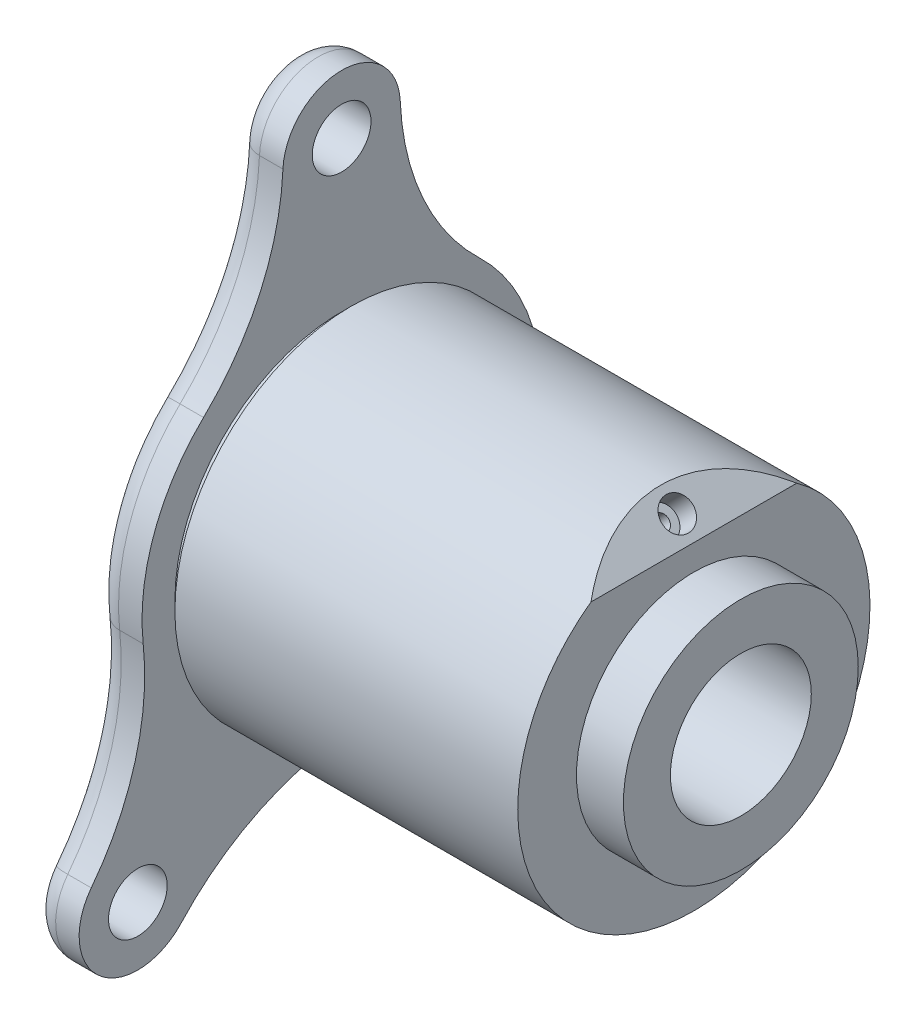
SolidWorks part; units mm, degrees
ref_plane "Front" through (0, 0, 0) normal (0, 0, 1) x (1, 0, 0)
ref_plane "Top" through (0, 0, 0) normal (0, 1, 0) x (1, 0, 0)
ref_plane "Right" through (0, 0, 0) normal (1, 0, 0) x (0, 0, -1)
sketch "Sketch1" plane through (0, 0, 0) normal (1, 0, 0) x (0, 0, -1)
  circle A0 centre (0, 0) radius 37.5
  dimension "D1" = 75
extrude "Base-Extrude" add sketch "Sketch1" along normal blind 75
sketch "Sketch2" plane through (75, 0, 0) normal (1, 0, 0) x (0, 0, -1)
  circle A0 centre (0, 0) radius 25
  dimension "D1" = 50
extrude "Boss-Extrude1" add sketch "Sketch2" along normal blind 10
sketch "Sketch3" plane through (0, 0, 0) normal (-1, 0, 0) x (0, 0, 1)
  line L0 (0, 67.5) -> (0, 0) construction
  line L1 (0, 0) -> (43.3882, -51.708) construction
  circle A2 centre (0, 0) radius 42.5
  arc A3 (-29.3956, 30.6944) -> (-2.7883, -42.4084) centre (0, 0) ccw
  arc A4 (12.4883, 68.0401) -> (-12.4883, 68.0401) centre (0, 67.5) ccw
  arc A5 (34.1687, -60.1491) -> (53.302, -44.0944) centre (43.3882, -51.708) ccw
  arc A6 (12.4883, 68.0401) -> (29.3956, 30.6944) centre (67.437, 70.4167) ccw
  arc A7 (-12.4883, 68.0401) -> (-29.3956, 30.6944) centre (-67.437, 70.4167) cw
  arc A8 (34.1687, -60.1491) -> (-2.7883, -42.4084) centre (-6.3967, -97.2899) ccw
  arc A9 (42.2483, -4.6182) -> (53.302, -44.0944) centre (96.9227, -10.5947) ccw
  arc A10 (42.2483, -4.6182) -> (29.3956, 30.6944) centre (0, 0) ccw
  circle A11 centre (0, 0) radius 67.5 construction
  dimension "D2" = 12.5
  dimension "D3" = 135
  dimension "D5" = 55
  dimension "D4" = 140
  dimension "D1" = 5
extrude "Boss-Extrude2" add sketch "Sketch3" along normal blind 10
sketch "Sketch4" plane through (0, 0, 0) normal (1, 0, 0) x (0, 0, -1)
  circle A0 centre (0, 67.5) radius 6.25
  circle A1 centre (-43.3882, -51.708) radius 6.25
  dimension "D1" = 12.5
extrude "Cut-Extrude1" cut sketch "Sketch4" against normal through all
sketch "Sketch6" plane through (-10, 0, 0) normal (-1, 0, 0) x (0, 0, 1)
  circle A0 centre (0, 0) radius 25 construction
  circle A1 centre (0, 0) radius 25
extrude "Boss-Extrude3" add sketch "Sketch6" along normal blind 2.5
sketch "Sketch5" plane through (85, 0, 0) normal (1, 0, 0) x (0, 0, -1)
  circle A0 centre (0, 0) radius 15
  dimension "D1" = 30
fillet "Fillet1" radius 5 1 edges at (-10, 0, 25)
extrude "Cut-Extrude2" cut sketch "Sketch5" against normal through all
sketch "Sketch7" plane through (0, 0, 0) normal (0, 0, 1) x (1, 0, 0)
  line L0 (0, -4.6182) -> (0, 30.6944) construction
  line L1 (2, 37.5) -> (0, 37.5)
  line L2 (2, 37.5) -> (2, 35.5)
  line L3 (2, 35.5) -> (0, 35.5)
  line L4 (0, 37.5) -> (0, 35.5)
  line L5 (75, 37.5) -> (0, 37.5) construction
  line L6 (-25.9192, 0) -> (98.3905, 0) construction
  dimension "D1" = 2
  dimension "D2" = 2
revolve "Cut-Revolve1" cut sketch "Sketch7" angle 360 about L6
fillet "Fillet3" radius 5 8 edges at (-10, 47.7332, 17.3325) (-10, 80, 0) (-10, 47.7332, -17.3325) (-10, -14.5359, -39.9369) (-10, -47.7068, 17.4049) (-10, -61.2836, 51.423) (-10, -25.4246, 43.9597) (-10, 14.5359, 39.9369)
sketch "Sketch14" plane through (0, 0, 0) normal (0, 0, 1) x (1, 0, 0)
  line L0 (67.9289, 37.5) -> (75, 30.4289)
  line L1 (75, -37.5) -> (75, 37.5) construction
  line L2 (75, 37.5) -> (2, 37.5) construction
  line L3 (50, 0) -> (-50, 0) construction
  dimension "D1" = 10
  dimension "D2" = 45
extrude "Cut-Extrude5" cut sketch "Sketch14" against normal through all and the other way through all
hole_wizard "CBORE for M3 SBHCS2" positions "Sketch16" profile "Sketch15" counterbore size "M3" standard "Ansi Metric"
sketch "Sketch16" plane through (52.7145, 52.7145, 0) normal (0.7071, 0.7071, 0) x (-0.7071, 0.7071, 0)
  line L1 (-31.5165, 0) -> (-21.5165, 0) construction
  line L2 (-31.5165, -21.9164) -> (-31.5165, 21.9164) construction
  ellipse E0 centre (-74.5495, 0) end of major axis (-127.5825, 0) minor radius 37.5 (-31.5165, -21.9164) -> (-31.5165, 21.9164) ccw construction
  point P0 (-26.5165, 0)
sketch "Sketch15" plane through (71.4645, 33.9645, 0) normal (0, 0, 1) x (-0.7071, 0.7071, 0)
  line L0 (0, 0) -> (0, 26.8198)
  line L1 (0, 26.8198) -> (1.7, 26.8198)
  line L3 (1.7, 26.8198) -> (1.7, 5)
  line L4 (1.7, 5) -> (3.35, 5)
  line L5 (3.35, 5) -> (3.35, 0)
  line L7 (3.35, 0) -> (0, 0)
  line L11 (0, -6.35) -> (0, 107.95) construction
  dimension "Thru Hole Dia." = 3.4
  dimension "Thru Hole Depth" = 26.8198
  dimension "C'Bore Dia." = 6.7
  dimension "C'Bore Depth" = 5
